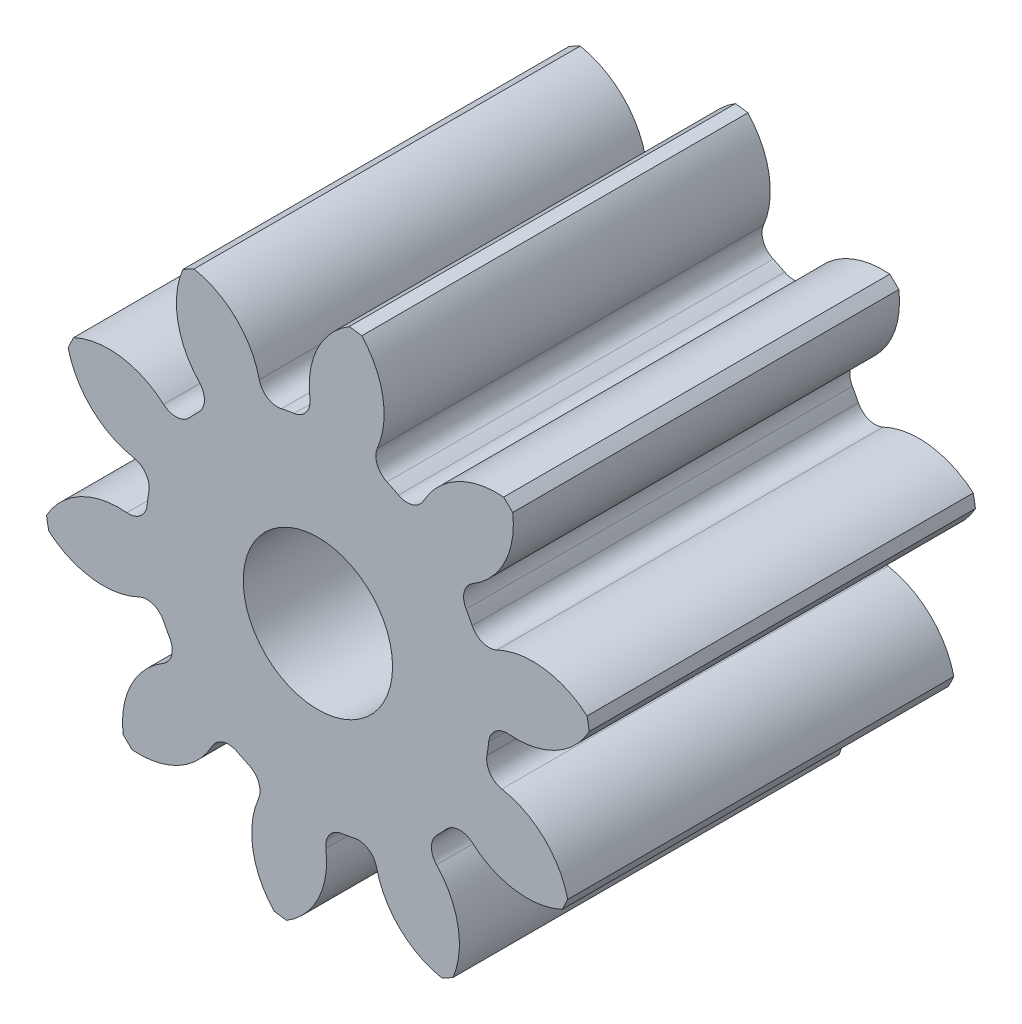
SolidWorks part; units mm, degrees
ref_plane "Front" through (0, 0, 0) normal (0, 0, 1) x (1, 0, 0)
ref_plane "Top" through (0, 0, 0) normal (0, 1, 0) x (1, 0, 0)
ref_plane "Right" through (0, 0, 0) normal (1, 0, 0) x (0, 0, -1)
sketch "Sketch3" plane through (0, 0, 0) normal (0, 0, 1) x (1, 0, 0)
  circle A0 centre (0, 0) radius 67.7333
  dimension "od" = 135.4667
extrude "gearBody" add sketch "Sketch3" along normal blind 95.25
sketch "Sketch2" plane through (0, 0, 0) normal (0, 0, 1) x (1, 0, 0)
  line L0 (0, 0) -> (49.003, 20.2977) construction
  line L1 (61.9438, -29.9067) -> (0, 0) construction
  line L2 (0, 0) -> (36.3143, 0) construction
  line L3 (56.4317, 1.1996) -> (53.9911, -16.4601) construction
  line L5 (55.2114, -7.6303) -> (0, 0) construction
  line L7 (0, 0) -> (53.0404, 0) construction
  arc A0 (53.04, 0.2073) -> (50.9957, -14.5851) centre (0, 0) ccw construction
  arc A1 (66.9337, 10.3773) -> (61.6102, -28.1422) centre (0, 0) ccw construction
  arc A2 (56.4317, 1.1996) -> (53.9911, -16.4601) centre (0, 0) ccw construction
  arc A3 (41.6888, -7.3588) -> (42.1221, -4.224) centre (0, 0) ccw
  arc A4 (61.9438, -29.9067) -> (45.3797, -12.6757) centre (41.661, -32.8275) ccw
  arc A5 (61.9438, -29.9067) -> (67.7333, 11.9852) centre (0, 0) ccw
  arc A6 (67.7333, 11.9852) -> (47.1167, -0.1073) centre (49.003, 20.2977) cw
  arc A7 (42.1221, -4.224) -> (47.1167, -0.1073) centre (46.6937, -4.6824) cw
  arc A8 (45.3797, -12.6757) -> (41.6888, -7.3588) centre (46.2135, -8.1574) cw
  point P6 (67.7333, 11.9852)
  point P22 (61.9438, -29.9067)
  dimension "baseDia" = 106.0809
  dimension "od" = 135.4667
  dimension "pd" = 112.8889
  dimension "rd" = 84.6667
  dimension "rFillet" = 4.5946
  dimension "pointX" = 67.7333
  dimension "pointY" = 11.9852
  dimension "CTT" = 17.6597
  dimension "flankCenterAngle" = 22.5
extrude "toothCut" cut sketch "Sketch2" along normal through all
pattern_circular "CirPattern1" count 10 over 360 about axis through (0, 0, 0) along (0, 0, 1) of "toothCut"
sketch "hub1Dia" plane through (0, 0, 0) normal (0, 0, -1) x (-1, 0, 0)
  circle A0 centre (0, 0) radius 12.7
  dimension "hub1Dia" = 25.4
sketch "hub2Dia" plane through (0, 0, 95.25) normal (0, 0, 1) x (1, 0, 0)
  circle A0 centre (0, 0) radius 12.7
  dimension "hub2dia" = 25.4
sketch "boreDia" plane through (0, 0, 0) normal (0, 0, 1) x (1, 0, 0)
  circle A0 centre (0, 0) radius 18.415
  dimension "boreDia" = 36.83
extrude "bore" cut sketch "boreDia" against normal mid plane 25400
